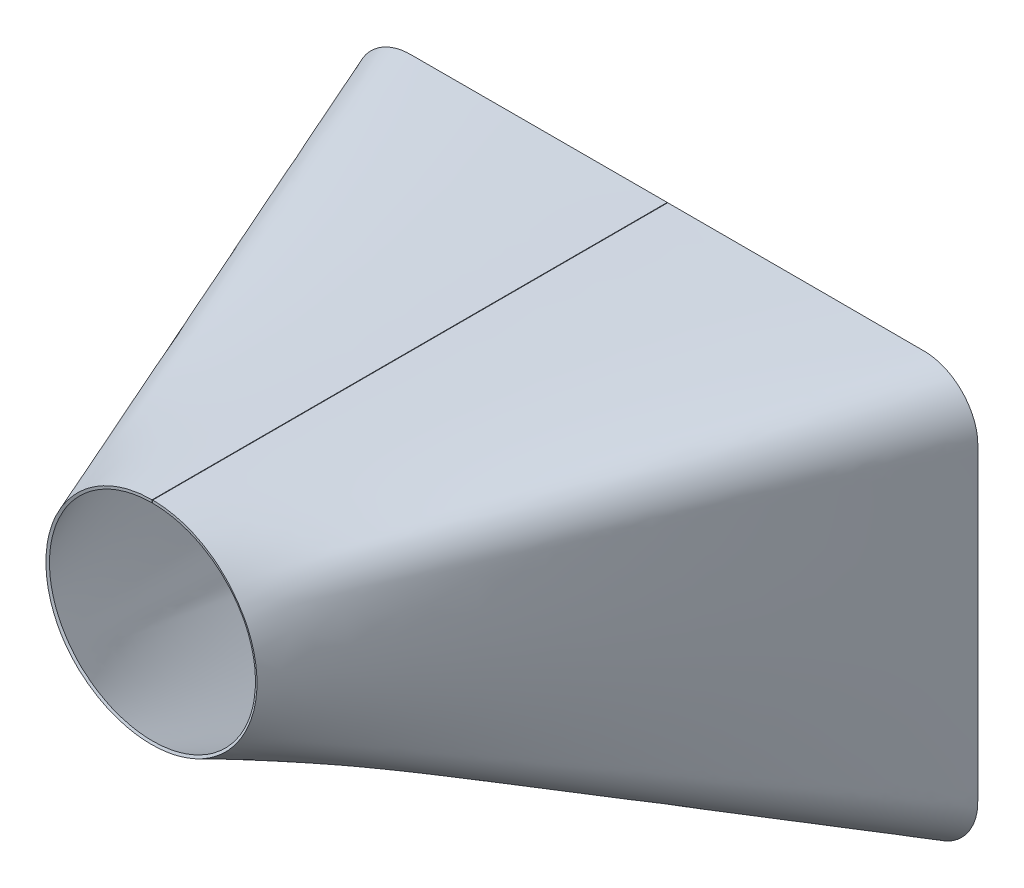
SolidWorks part; units mm, degrees
ref_plane "Front Plane" through (0, 0, 0) normal (0, 0, 1) x (1, 0, 0)
ref_plane "Top Plane" through (0, 0, 0) normal (0, 1, 0) x (1, 0, 0)
ref_plane "Right Plane" through (0, 0, 0) normal (1, 0, 0) x (0, 0, -1)
sketch "Rect Profile" plane through (0, 0, 0) normal (0, 0, 1) x (1, 0, 0)
  line L0 (0, -400) -> (0, 0) construction
  line L1 (-250, 0) -> (-0.25, 0)
  line L2 (-300, -50) -> (-300, -350)
  line L3 (-250, -400) -> (250, -400)
  line L4 (300, -50) -> (300, -350)
  line L5 (0.25, 0) -> (250, 0)
  arc A0 (-300, -350) -> (-250, -400) centre (-250, -350) ccw
  arc A1 (250, -400) -> (300, -350) centre (250, -350) ccw
  arc A2 (250, 0) -> (300, -50) centre (250, -50) cw
  arc A3 (-250, 0) -> (-300, -50) centre (-250, -50) ccw
  point P9 (-300, -400)
  point P14 (300, -400)
  point P17 (300, 0)
ref_plane "Transition Height" through (0, 0, 500) normal (0, 0, 1) x (1, 0, 0)
sketch "Circ Profile" plane through (0, 0, 500) normal (0, 0, 1) x (1, 0, 0)
  line L0 (0, -100) -> (0, 0) construction
  arc A1 (-0.25, -0.0003) -> (0.25, -0.0003) centre (0, -100) ccw
lofted bend "Lofted Bends2" thickness 2.6568 parameters "D1"=0
other "Freeform Bend1" parameters "D1"=1000, "D4"=57.296, "D5"=1
sketch "Bend-Lines1" [suppressed] plane through (0, 0, 0) normal (0, 1, 0) x (1, 0, 0)
sketch "Bounding-Box1" [suppressed] plane through (0, 0, 0) normal (0, 1, 0) x (1, 0, 0)
sheet metal parameters "Sheet-Metal2" thickness 2.6568 parameters "D1"=5.08
flat pattern "Flat-Pattern2"
sketch "Bend-Lines3" plane through (0, 0, 0) normal (0, 1, 0) x (1, 0, 0)
sketch3d "Bounding-Box3" [suppressed]
  line L0 (-367.7679, -1089.8314, 0) -> (183.8215, 169.4855, 0) construction
  line L1 (-1033.873, -798.0728, 0) -> (-482.2837, 461.2441, 0) construction
  line L2 (-367.7679, -1089.8314, 0) -> (-1033.873, -798.0728, 0) construction
  line L3 (183.8215, 169.4855, 0) -> (-482.2837, 461.2441, 0) construction
other "Flatten-<Freeform Bend1>1"
equation "\"Gap\"=0.5"
equation "\"D1@Circ Profile\" = \"Gap\""
equation "\"D3@Rect Profile\"=\"Gap\""
